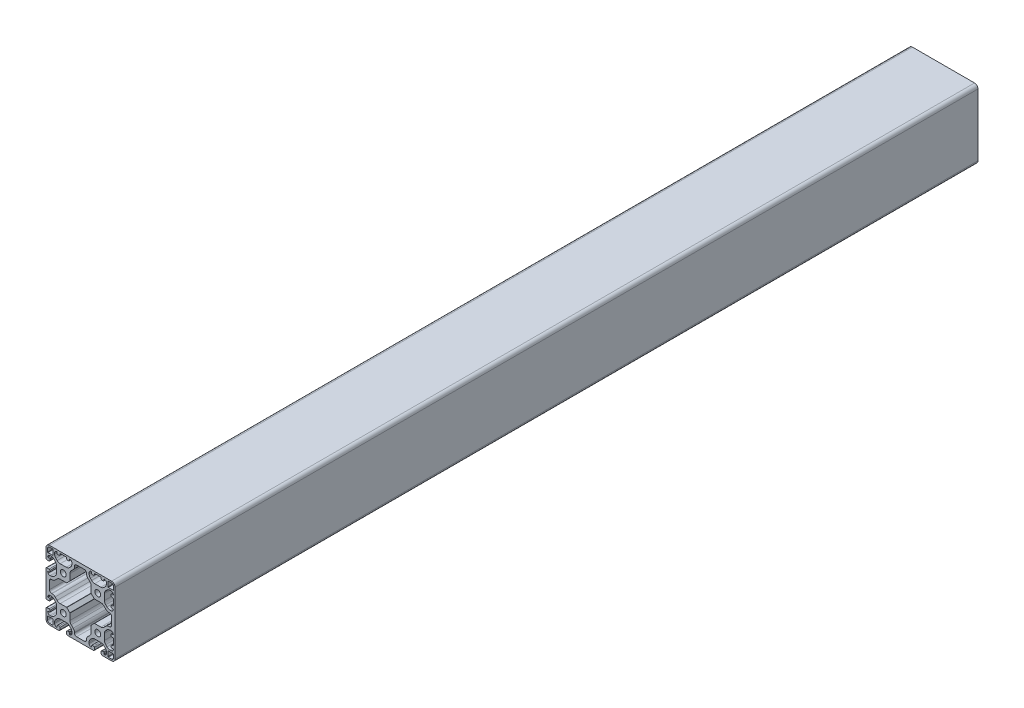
SolidWorks part; units mm, degrees
ref_plane "Ebene vorne" through (0, 0, 0) normal (0, 0, 1) x (1, 0, 0)
ref_plane "Ebene oben" through (0, 0, 0) normal (0, 1, 0) x (1, 0, 0)
ref_plane "Ebene rechts" through (0, 0, 0) normal (1, 0, 0) x (0, 0, -1)
sketch "Skizze1" plane through (0, 0, 0) normal (0, 1, 0) x (1, 0, 0)
  line L0 (0, 0) -> (0, 1000)
  dimension "D1" = 1000
other "Strukturbauteil1"
ref_plane "Ebene1" through (0, 0, 0) normal (0, 0, -1) x (0, -1, 0)
sketch "Model1" plane through (0, 0, 0) normal (0, 0, -1) x (0, -1, 0)
  line L0 (-40, -20) -> (40, -20) construction
  line L1 (-40, 20) -> (40, 20) construction
  line L2 (-20, 40) -> (-20, -40) construction
  line L3 (20, 40) -> (20, -40) construction
  line L4 (-29.2145, 27.0931) -> (-30.6569, 28.5355)
  line L5 (-11.4645, -30.6569) -> (-12.9069, -29.2145)
  line L6 (-27.0931, -10.7855) -> (-29.4142, -8.4645)
  line L7 (-8.4645, -29.4142) -> (-10.7855, -27.0931)
  line L8 (-12.3964, -15.8878) -> (-15.8878, -12.3964)
  line L9 (-29.2145, -12.9069) -> (-30.6569, -11.4645)
  line L10 (15.8878, 12.3964) -> (12.3964, 15.8878)
  line L11 (10.7855, 27.0931) -> (8.4645, 29.4142)
  line L12 (29.4142, 8.4645) -> (27.0931, 10.7855)
  line L13 (28.5355, -30.6569) -> (27.0931, -29.2145)
  line L14 (30.6569, -28.5355) -> (29.2145, -27.0931)
  line L15 (30.6569, 11.4645) -> (29.2145, 12.9069)
  line L16 (12.9069, 29.2145) -> (11.4645, 30.6569)
  line L17 (-27.0931, 29.2145) -> (-28.5355, 30.6569)
  line L18 (-36, -40) -> (36, -40)
  line L19 (32.3, -38.2) -> (36, -38.2)
  line L20 (-36, -38.2) -> (-32.3, -38.2)
  line L21 (16.5, -38) -> (23.5, -38)
  line L22 (-23.5, -38) -> (-16.5, -38)
  line L23 (-4.5, -36) -> (4.5, -36)
  line L24 (13.5, -35.5) -> (15, -35.5)
  line L25 (25, -35.5) -> (26.5, -35.5)
  line L26 (-26.5, -35.5) -> (-25, -35.5)
  line L27 (-15, -35.5) -> (-13.5, -35.5)
  line L28 (32.3, -31.8) -> (37.7, -31.8)
  line L29 (-37.7, -31.8) -> (-32.3, -31.8)
  line L30 (34.1924, -30) -> (35.5, -30)
  line L31 (-35.5, -30) -> (-34.1924, -30)
  line L32 (16.4424, -27.75) -> (23.5576, -27.75)
  line L33 (-23.5576, -27.75) -> (-16.4424, -27.75)
  line L34 (36, -27) -> (37.55, -27)
  line L35 (-37.5, -27) -> (-36, -27)
  line L36 (36.5, -24) -> (39, -24)
  line L37 (-37.5, -24) -> (-36.5, -24)
  line L38 (36.5, -16) -> (39, -16)
  line L39 (-37.5, -16) -> (-36.5, -16)
  line L40 (36, -13) -> (37.55, -13)
  line L41 (-37.5, -13) -> (-36, -13)
  line L42 (16.2414, -12.25) -> (23.5576, -12.25)
  line L43 (-23.5576, -12.25) -> (-16.2414, -12.25)
  line L44 (34.1924, -10) -> (35.5, -10)
  line L45 (-35.5, -10) -> (-34.1924, -10)
  line L46 (-33.5, -7) -> (-32.9497, -7)
  line L47 (32.9497, -7) -> (33.5, -7)
  line L48 (-33.5, 7) -> (-32.9497, 7)
  line L49 (32.9497, 7) -> (33.5, 7)
  line L50 (34.1924, 10) -> (35.5, 10)
  line L51 (-35.5, 10) -> (-34.1924, 10)
  line L52 (-23.5576, 12.25) -> (-16.2414, 12.25)
  line L53 (16.2414, 12.25) -> (23.5576, 12.25)
  line L54 (36, 13) -> (37.55, 13)
  line L55 (-37.5, 13) -> (-36, 13)
  line L56 (36.5, 16) -> (39, 16)
  line L57 (-37.5, 16) -> (-36.5, 16)
  line L58 (36.5, 24) -> (39, 24)
  line L59 (-37.5, 24) -> (-36.5, 24)
  line L60 (36, 27) -> (37.55, 27)
  line L61 (-37.5, 27) -> (-36, 27)
  line L62 (16.4424, 27.75) -> (23.5576, 27.75)
  line L63 (-23.5576, 27.75) -> (-16.4424, 27.75)
  line L64 (34.1924, 30) -> (35.5, 30)
  line L65 (-35.5, 30) -> (-34.1924, 30)
  line L66 (-37.7, 31.8) -> (-32.3, 31.8)
  line L67 (32.3, 31.8) -> (37.7, 31.8)
  line L68 (25, 35.5) -> (26.5, 35.5)
  line L69 (13.5, 35.5) -> (15, 35.5)
  line L70 (-15, 35.5) -> (-13.5, 35.5)
  line L71 (-26.5, 35.5) -> (-25, 35.5)
  line L72 (-4.5, 36) -> (4.5, 36)
  line L73 (27.45, 38) -> (27.5, 38)
  line L74 (12.5, 38) -> (12.55, 38)
  line L75 (-12.55, 38) -> (-12.5, 38)
  line L76 (-27.5, 38) -> (-27.45, 38)
  line L77 (-36, 38.2) -> (-32.3, 38.2)
  line L78 (32.3, 38.2) -> (36, 38.2)
  line L79 (25, 40) -> (36, 40)
  line L80 (-15, 40) -> (15, 40)
  line L81 (-36, 40) -> (-25, 40)
  line L82 (-30.6569, 11.4645) -> (-29.2145, 12.9069)
  line L83 (-28.5355, -30.6569) -> (-27.0931, -29.2145)
  line L84 (-30.6569, -28.5355) -> (-29.2145, -27.0931)
  line L85 (12.3964, -15.8878) -> (15.8878, -12.3964)
  line L86 (27.0931, -10.7855) -> (29.4142, -8.4645)
  line L87 (8.4645, -29.4142) -> (10.7855, -27.0931)
  line L88 (-29.4142, 8.4645) -> (-27.0931, 10.7855)
  line L89 (-15.8878, 12.3964) -> (-12.3964, 15.8878)
  line L90 (-10.7855, 27.0931) -> (-8.4645, 29.4142)
  line L91 (27.0931, 29.2145) -> (28.5355, 30.6569)
  line L92 (11.4645, -30.6569) -> (12.9069, -29.2145)
  line L93 (-12.9069, 29.2145) -> (-11.4645, 30.6569)
  line L94 (29.2145, -12.9069) -> (30.6569, -11.4645)
  line L95 (29.2145, 27.0931) -> (30.6569, 28.5355)
  line L96 (-40, -36) -> (-40, 36)
  line L97 (-38.2, 32.3) -> (-38.2, 36)
  line L98 (-38.2, -36) -> (-38.2, -32.3)
  line L99 (-38, 16.5) -> (-38, 23.5)
  line L100 (-38, -23.5) -> (-38, -16.5)
  line L101 (-36, -4.5) -> (-36, 4.5)
  line L102 (-35.5, 25) -> (-35.5, 26.5)
  line L103 (-35.5, 13.5) -> (-35.5, 15)
  line L104 (-35.5, -15) -> (-35.5, -13.5)
  line L105 (-35.5, -26.5) -> (-35.5, -25)
  line L106 (-31.8, 32.3) -> (-31.8, 37.7)
  line L107 (-31.8, -37.7) -> (-31.8, -32.3)
  line L108 (-30, 34.1924) -> (-30, 35.5)
  line L109 (-30, -35.5) -> (-30, -34.1924)
  line L110 (-27.75, 16.4424) -> (-27.75, 23.5576)
  line L111 (-27.75, -23.5576) -> (-27.75, -16.4424)
  line L112 (-27, 36) -> (-27, 37.55)
  line L113 (-27, -37.5) -> (-27, -36)
  line L114 (-24, 36.5) -> (-24, 39)
  line L115 (-24, -37.5) -> (-24, -36.5)
  line L116 (-16, 36.5) -> (-16, 39)
  line L117 (-16, -37.5) -> (-16, -36.5)
  line L118 (-13, 36) -> (-13, 37.55)
  line L119 (-13, -37.5) -> (-13, -36)
  line L120 (-12.25, 16.2414) -> (-12.25, 23.5576)
  line L121 (-12.25, -23.5576) -> (-12.25, -16.2414)
  line L122 (-10, 34.1924) -> (-10, 35.5)
  line L123 (-10, -35.5) -> (-10, -34.1924)
  line L124 (-7, 32.9497) -> (-7, 33.5)
  line L125 (-7, -33.5) -> (-7, -32.9497)
  line L126 (7, 32.9497) -> (7, 33.5)
  line L127 (7, -33.5) -> (7, -32.9497)
  line L128 (10, 34.1924) -> (10, 35.5)
  line L129 (10, -35.5) -> (10, -34.1924)
  line L130 (12.25, 16.2414) -> (12.25, 23.5576)
  line L131 (12.25, -23.5576) -> (12.25, -16.2414)
  line L132 (13, 36) -> (13, 37.55)
  line L133 (13, -37.5) -> (13, -36)
  line L134 (16, 36.5) -> (16, 39)
  line L135 (16, -37.5) -> (16, -36.5)
  line L136 (24, 36.5) -> (24, 39)
  line L137 (24, -37.5) -> (24, -36.5)
  line L138 (27, 36) -> (27, 37.55)
  line L139 (27, -37.5) -> (27, -36)
  line L140 (27.75, -23.5576) -> (27.75, -16.4424)
  line L141 (27.75, 16.4424) -> (27.75, 23.5576)
  line L142 (30, 34.1924) -> (30, 35.5)
  line L143 (30, -35.5) -> (30, -34.1924)
  line L144 (31.8, 32.3) -> (31.8, 37.7)
  line L145 (31.8, -37.7) -> (31.8, -32.3)
  line L146 (35.5, -26.5) -> (35.5, -25)
  line L147 (35.5, -15) -> (35.5, -13.5)
  line L148 (35.5, 13.5) -> (35.5, 15)
  line L149 (35.5, 25) -> (35.5, 26.5)
  line L150 (36, -4.5) -> (36, 4.5)
  line L151 (38, -27.5) -> (38, -27.45)
  line L152 (38, -12.55) -> (38, -12.5)
  line L153 (38, 12.5) -> (38, 12.55)
  line L154 (38, 27.45) -> (38, 27.5)
  line L155 (38.2, 32.3) -> (38.2, 36)
  line L156 (38.2, -36) -> (38.2, -32.3)
  line L157 (40, 25) -> (40, 36)
  line L158 (40, -36) -> (40, -25)
  line L159 (40, -15) -> (40, 15)
  line L161 (-40, 40) -> (40, 40) construction
  line L162 (-40, 40) -> (-40, -40) construction
  line L163 (-40, -40) -> (40, -40) construction
  line L164 (40, 40) -> (40, -40) construction
  line L165 (-40, 40) -> (40, -40) construction
  line L166 (-40, -40) -> (40, 40) construction
  arc A0 (-37.7, -31.8) -> (-38.2, -32.3) centre (-37.7, -32.3) ccw
  arc A1 (-38.2, 32.3) -> (-37.7, 31.8) centre (-37.7, 32.3) ccw
  arc A2 (-37.5, -27) -> (-38, -27.5) centre (-37.5, -27.5) ccw
  arc A3 (-38, -23.5) -> (-37.5, -24) centre (-37.5, -23.5) ccw
  arc A4 (-37.5, -16) -> (-38, -16.5) centre (-37.5, -16.5) ccw
  arc A5 (-38, -12.5) -> (-37.5, -13) centre (-37.5, -12.5) ccw
  arc A6 (-37.5, 13) -> (-38, 12.5) centre (-37.5, 12.5) ccw
  arc A7 (-38, 16.5) -> (-37.5, 16) centre (-37.5, 16.5) ccw
  arc A8 (-37.5, 24) -> (-38, 23.5) centre (-37.5, 23.5) ccw
  arc A9 (-38, 27.5) -> (-37.5, 27) centre (-37.5, 27.5) ccw
  arc A10 (-35.5, -25) -> (-36.5, -24) centre (-36.5, -25) ccw
  arc A11 (-36.5, -16) -> (-35.5, -15) centre (-36.5, -15) ccw
  arc A12 (-35.5, 15) -> (-36.5, 16) centre (-36.5, 15) ccw
  arc A13 (-36.5, 24) -> (-35.5, 25) centre (-36.5, 25) ccw
  arc A14 (-38.2, -36) -> (-36, -38.2) centre (-36, -36) ccw
  arc A15 (-40, -36) -> (-36, -40) centre (-36, -36) ccw
  arc A16 (-36, -27) -> (-35.5, -26.5) centre (-36, -26.5) ccw
  arc A17 (-35.5, -13.5) -> (-36, -13) centre (-36, -13.5) ccw
  arc A18 (-36, 13) -> (-35.5, 13.5) centre (-36, 13.5) ccw
  arc A19 (-35.5, 26.5) -> (-36, 27) centre (-36, 26.5) ccw
  arc A20 (-36, 38.2) -> (-38.2, 36) centre (-36, 36) ccw
  arc A21 (-36, 40) -> (-40, 36) centre (-36, 36) ccw
  arc A22 (-38, -27.5) -> (-35.5, -30) centre (-35.5, -27.5) ccw
  arc A23 (-35.5, -10) -> (-38, -12.5) centre (-35.5, -12.5) ccw
  arc A24 (-38, 12.5) -> (-35.5, 10) centre (-35.5, 12.5) ccw
  arc A25 (-35.5, 30) -> (-38, 27.5) centre (-35.5, 27.5) ccw
  arc A26 (-34.1924, -30) -> (-30.6569, -28.5355) centre (-34.1924, -25) ccw
  arc A27 (-30.6569, -11.4645) -> (-34.1924, -10) centre (-34.1924, -15) ccw
  arc A28 (-34.1924, 10) -> (-30.6569, 11.4645) centre (-34.1924, 15) ccw
  arc A29 (-30.6569, 28.5355) -> (-34.1924, 30) centre (-34.1924, 25) ccw
  arc A30 (-33.5, 7) -> (-36, 4.5) centre (-33.5, 4.5) ccw
  arc A31 (-36, -4.5) -> (-33.5, -7) centre (-33.4973, -4.4973) ccw
  arc A32 (-29.4142, -8.4645) -> (-32.9497, -7) centre (-32.9497, -12) ccw
  arc A33 (-32.9497, 7) -> (-31.0363, 7.3806) centre (-32.9497, 12) ccw
  arc A34 (-31.0363, 7.3806) -> (-29.4142, 8.4645) centre (-32.9497, 12) ccw
  arc A35 (-29.2145, -27.0931) -> (-27.75, -23.5576) centre (-32.75, -23.5576) ccw
  arc A36 (-27.75, -16.4424) -> (-29.2145, -12.9069) centre (-32.75, -16.4424) ccw
  arc A37 (-29.2145, 12.9069) -> (-27.75, 16.4424) centre (-32.75, 16.4424) ccw
  arc A38 (-27.75, 23.5576) -> (-29.2145, 27.0931) centre (-32.75, 23.5576) ccw
  arc A39 (-32.3, -38.2) -> (-31.8, -37.7) centre (-32.3, -37.7) ccw
  arc A40 (-31.8, -32.3) -> (-32.3, -31.8) centre (-32.3, -32.3) ccw
  arc A41 (-32.3, 31.8) -> (-31.8, 32.3) centre (-32.3, 32.3) ccw
  arc A42 (-31.8, 37.7) -> (-32.3, 38.2) centre (-32.3, 37.7) ccw
  arc A43 (-27.5, -38) -> (-27, -37.5) centre (-27.5, -37.5) ccw
  arc A44 (-30, -35.5) -> (-27.5, -38) centre (-27.5, -35.5) ccw
  arc A45 (-27.5, 38) -> (-30, 35.5) centre (-27.5, 35.5) ccw
  arc A46 (-27, 37.55) -> (-27.45, 38) centre (-27.45, 37.55) ccw
  arc A47 (-26.5, -35.5) -> (-27, -36) centre (-26.5, -36) ccw
  arc A48 (-27, 36) -> (-26.5, 35.5) centre (-26.5, 36) ccw
  arc A49 (-24, -36.5) -> (-25, -35.5) centre (-25, -36.5) ccw
  arc A50 (-28.5355, -30.6569) -> (-30, -34.1924) centre (-25, -34.1924) ccw
  arc A51 (-30, 34.1924) -> (-28.5355, 30.6569) centre (-25, 34.1924) ccw
  arc A52 (-25, 35.5) -> (-24, 36.5) centre (-25, 36.5) ccw
  arc A53 (-24, 39) -> (-25, 40) centre (-25, 39) ccw
  arc A54 (-23.5576, -27.75) -> (-27.0931, -29.2145) centre (-23.5576, -32.75) ccw
  arc A55 (-25.471, -11.8694) -> (-23.5576, -12.25) centre (-23.5576, -7.25) ccw
  arc A56 (-27.0931, -10.7855) -> (-25.471, -11.8694) centre (-23.5576, -7.25) ccw
  arc A57 (-23.5576, 12.25) -> (-27.0931, 10.7855) centre (-23.5576, 7.25) ccw
  arc A58 (-27.0931, 29.2145) -> (-23.5576, 27.75) centre (-23.5576, 32.75) ccw
  arc A59 (-24, -37.5) -> (-23.5, -38) centre (-23.5, -37.5) ccw
  circle A60 centre (-20, -20) radius 3.4
  circle A61 centre (-20, 20) radius 3.4
  arc A62 (-16.5, -38) -> (-16, -37.5) centre (-16.5, -37.5) ccw
  arc A63 (-12.9069, -29.2145) -> (-16.4424, -27.75) centre (-16.4424, -32.75) ccw
  arc A64 (-16.4424, 27.75) -> (-12.9069, 29.2145) centre (-16.4424, 32.75) ccw
  arc A65 (-15.8878, -12.3964) -> (-16.2414, -12.25) centre (-16.2414, -12.75) ccw
  arc A66 (-16.2414, 12.25) -> (-15.8878, 12.3964) centre (-16.2414, 12.75) ccw
  arc A67 (-15, -35.5) -> (-16, -36.5) centre (-15, -36.5) ccw
  arc A68 (-10, -34.1924) -> (-11.4645, -30.6569) centre (-15, -34.1924) ccw
  arc A69 (-11.4645, 30.6569) -> (-10, 34.1924) centre (-15, 34.1924) ccw
  arc A70 (-16, 36.5) -> (-15, 35.5) centre (-15, 36.5) ccw
  arc A71 (-15, 40) -> (-16, 39) centre (-15, 39) ccw
  arc A72 (-13, -36) -> (-13.5, -35.5) centre (-13.5, -36) ccw
  arc A73 (-13.5, 35.5) -> (-13, 36) centre (-13.5, 36) ccw
  arc A74 (-12.25, -16.2414) -> (-12.3964, -15.8878) centre (-12.75, -16.2414) ccw
  arc A75 (-12.3964, 15.8878) -> (-12.25, 16.2414) centre (-12.75, 16.2414) ccw
  arc A76 (-12.55, 38) -> (-13, 37.55) centre (-12.55, 37.55) ccw
  arc A77 (-13, -37.5) -> (-12.5, -38) centre (-12.5, -37.5) ccw
  arc A78 (-12.5, -38) -> (-10, -35.5) centre (-12.5, -35.5) ccw
  arc A79 (-10, 35.5) -> (-12.5, 38) centre (-12.5, 35.5) ccw
  arc A80 (-7, -32.9497) -> (-7.3806, -31.0363) centre (-12, -32.9497) ccw
  arc A81 (-7.3806, -31.0363) -> (-8.4645, -29.4142) centre (-12, -32.9497) ccw
  arc A82 (-8.4645, 29.4142) -> (-7, 32.9497) centre (-12, 32.9497) ccw
  arc A83 (-12.25, -23.5576) -> (-10.7855, -27.0931) centre (-7.25, -23.5576) ccw
  arc A84 (-11.8694, 25.471) -> (-12.25, 23.5576) centre (-7.25, 23.5576) ccw
  arc A85 (-10.7855, 27.0931) -> (-11.8694, 25.471) centre (-7.25, 23.5576) ccw
  arc A86 (-7, -33.5) -> (-4.5, -36) centre (-4.5, -33.5) ccw
  arc A87 (-4.5, 36) -> (-7, 33.5) centre (-4.5, 33.5) ccw
  arc A88 (4.5, -36) -> (7, -33.5) centre (4.5, -33.5) ccw
  arc A89 (7, 33.5) -> (4.5, 36) centre (4.5, 33.5) ccw
  arc A90 (11.8694, -25.471) -> (12.25, -23.5576) centre (7.25, -23.5576) ccw
  arc A91 (10.7855, -27.0931) -> (11.8694, -25.471) centre (7.25, -23.5576) ccw
  arc A92 (12.25, 23.5576) -> (10.7855, 27.0931) centre (7.25, 23.5576) ccw
  arc A93 (8.4645, -29.4142) -> (7, -32.9497) centre (12, -32.9497) ccw
  arc A94 (7, 32.9497) -> (7.3806, 31.0363) centre (12, 32.9497) ccw
  arc A95 (7.3806, 31.0363) -> (8.4645, 29.4142) centre (12, 32.9497) ccw
  arc A96 (12.5, -38) -> (13, -37.5) centre (12.5, -37.5) ccw
  arc A97 (10, -35.5) -> (12.5, -38) centre (12.5, -35.5) ccw
  arc A98 (12.5, 38) -> (10, 35.5) centre (12.5, 35.5) ccw
  arc A99 (13, 37.55) -> (12.55, 38) centre (12.55, 37.55) ccw
  arc A100 (12.3964, -15.8878) -> (12.25, -16.2414) centre (12.75, -16.2414) ccw
  arc A101 (12.25, 16.2414) -> (12.3964, 15.8878) centre (12.75, 16.2414) ccw
  arc A102 (13.5, -35.5) -> (13, -36) centre (13.5, -36) ccw
  arc A103 (13, 36) -> (13.5, 35.5) centre (13.5, 36) ccw
  arc A104 (16, -36.5) -> (15, -35.5) centre (15, -36.5) ccw
  arc A105 (11.4645, -30.6569) -> (10, -34.1924) centre (15, -34.1924) ccw
  arc A106 (10, 34.1924) -> (11.4645, 30.6569) centre (15, 34.1924) ccw
  arc A107 (15, 35.5) -> (16, 36.5) centre (15, 36.5) ccw
  arc A108 (16, 39) -> (15, 40) centre (15, 39) ccw
  arc A109 (16.2414, -12.25) -> (15.8878, -12.3964) centre (16.2414, -12.75) ccw
  arc A110 (15.8878, 12.3964) -> (16.2414, 12.25) centre (16.2414, 12.75) ccw
  arc A111 (16.4424, -27.75) -> (12.9069, -29.2145) centre (16.4424, -32.75) ccw
  arc A112 (12.9069, 29.2145) -> (16.4424, 27.75) centre (16.4424, 32.75) ccw
  arc A113 (16, -37.5) -> (16.5, -38) centre (16.5, -37.5) ccw
  circle A114 centre (20, -20) radius 3.4
  circle A115 centre (20, 20) radius 3.4
  arc A116 (23.5, -38) -> (24, -37.5) centre (23.5, -37.5) ccw
  arc A117 (27.0931, -29.2145) -> (23.5576, -27.75) centre (23.5576, -32.75) ccw
  arc A118 (23.5576, -12.25) -> (27.0931, -10.7855) centre (23.5576, -7.25) ccw
  arc A119 (25.471, 11.8694) -> (23.5576, 12.25) centre (23.5576, 7.25) ccw
  arc A120 (27.0931, 10.7855) -> (25.471, 11.8694) centre (23.5576, 7.25) ccw
  arc A121 (23.5576, 27.75) -> (27.0931, 29.2145) centre (23.5576, 32.75) ccw
  arc A122 (25, -35.5) -> (24, -36.5) centre (25, -36.5) ccw
  arc A123 (30, -34.1924) -> (28.5355, -30.6569) centre (25, -34.1924) ccw
  arc A124 (28.5355, 30.6569) -> (30, 34.1924) centre (25, 34.1924) ccw
  arc A125 (24, 36.5) -> (25, 35.5) centre (25, 36.5) ccw
  arc A126 (25, 40) -> (24, 39) centre (25, 39) ccw
  arc A127 (27, -36) -> (26.5, -35.5) centre (26.5, -36) ccw
  arc A128 (26.5, 35.5) -> (27, 36) centre (26.5, 36) ccw
  arc A129 (27.45, 38) -> (27, 37.55) centre (27.45, 37.55) ccw
  arc A130 (27, -37.5) -> (27.5, -38) centre (27.5, -37.5) ccw
  arc A131 (27.5, -38) -> (30, -35.5) centre (27.5, -35.5) ccw
  arc A132 (30, 35.5) -> (27.5, 38) centre (27.5, 35.5) ccw
  arc A133 (31.8, -37.7) -> (32.3, -38.2) centre (32.3, -37.7) ccw
  arc A134 (32.3, -31.8) -> (31.8, -32.3) centre (32.3, -32.3) ccw
  arc A135 (31.8, 32.3) -> (32.3, 31.8) centre (32.3, 32.3) ccw
  arc A136 (32.3, 38.2) -> (31.8, 37.7) centre (32.3, 37.7) ccw
  arc A137 (27.75, -23.5576) -> (29.2145, -27.0931) centre (32.75, -23.5576) ccw
  arc A138 (29.2145, -12.9069) -> (27.75, -16.4424) centre (32.75, -16.4424) ccw
  arc A139 (27.75, 16.4424) -> (29.2145, 12.9069) centre (32.75, 16.4424) ccw
  arc A140 (29.2145, 27.0931) -> (27.75, 23.5576) centre (32.75, 23.5576) ccw
  arc A141 (32.9497, -7) -> (31.0363, -7.3806) centre (32.9497, -12) ccw
  arc A142 (31.0363, -7.3806) -> (29.4142, -8.4645) centre (32.9497, -12) ccw
  arc A143 (29.4142, 8.4645) -> (32.9497, 7) centre (32.9497, 12) ccw
  arc A144 (33.5, -7) -> (36, -4.5) centre (33.5, -4.5) ccw
  arc A145 (36, 4.5) -> (33.5, 7) centre (33.5, 4.5) ccw
  arc A146 (30.6569, -28.5355) -> (34.1924, -30) centre (34.1924, -25) ccw
  arc A147 (34.1924, -10) -> (30.6569, -11.4645) centre (34.1924, -15) ccw
  arc A148 (30.6569, 11.4645) -> (34.1924, 10) centre (34.1924, 15) ccw
  arc A149 (34.1924, 30) -> (30.6569, 28.5355) centre (34.1924, 25) ccw
  arc A150 (35.5, -30) -> (38, -27.5) centre (35.5, -27.5) ccw
  arc A151 (38, -12.5) -> (35.5, -10) centre (35.5, -12.5) ccw
  arc A152 (35.5, 10) -> (38, 12.5) centre (35.5, 12.5) ccw
  arc A153 (38, 27.5) -> (35.5, 30) centre (35.5, 27.5) ccw
  arc A154 (36, -38.2) -> (38.2, -36) centre (36, -36) ccw
  arc A155 (36, -40) -> (40, -36) centre (36, -36) ccw
  arc A156 (35.5, -26.5) -> (36, -27) centre (36, -26.5) ccw
  arc A157 (36, -13) -> (35.5, -13.5) centre (36, -13.5) ccw
  arc A158 (35.5, 13.5) -> (36, 13) centre (36, 13.5) ccw
  arc A159 (36, 27) -> (35.5, 26.5) centre (36, 26.5) ccw
  arc A160 (38.2, 36) -> (36, 38.2) centre (36, 36) ccw
  arc A161 (40, 36) -> (36, 40) centre (36, 36) ccw
  arc A162 (36.5, -24) -> (35.5, -25) centre (36.5, -25) ccw
  arc A163 (35.5, -15) -> (36.5, -16) centre (36.5, -15) ccw
  arc A164 (36.5, 16) -> (35.5, 15) centre (36.5, 15) ccw
  arc A165 (35.5, 25) -> (36.5, 24) centre (36.5, 25) ccw
  arc A166 (38, -27.45) -> (37.55, -27) centre (37.55, -27.45) ccw
  arc A167 (37.55, -13) -> (38, -12.55) centre (37.55, -12.55) ccw
  arc A168 (38, 12.55) -> (37.55, 13) centre (37.55, 12.55) ccw
  arc A169 (37.55, 27) -> (38, 27.45) centre (37.55, 27.45) ccw
  arc A170 (38.2, -32.3) -> (37.7, -31.8) centre (37.7, -32.3) ccw
  arc A171 (37.7, 31.8) -> (38.2, 32.3) centre (37.7, 32.3) ccw
  arc A172 (40, -25) -> (39, -24) centre (39, -25) ccw
  arc A173 (39, -16) -> (40, -15) centre (39, -15) ccw
  arc A174 (40, 15) -> (39, 16) centre (39, 15) ccw
  arc A175 (39, 24) -> (40, 25) centre (39, 25) ccw
  point P508 (0, 0)
  point P509 (40, 0)
  point P510 (40, -20)
  point P511 (0, -40)
  point P512 (40, 20)
  point P513 (40, 40)
  point P514 (40, -40)
  point P515 (20, -40)
  point P516 (-40, 0)
  point P517 (-40, -40)
  point P518 (-40, -20)
  point P519 (0, 0)
  point P520 (-40, 20)
  point P521 (-40, 40)
  point P522 (0, 0)
